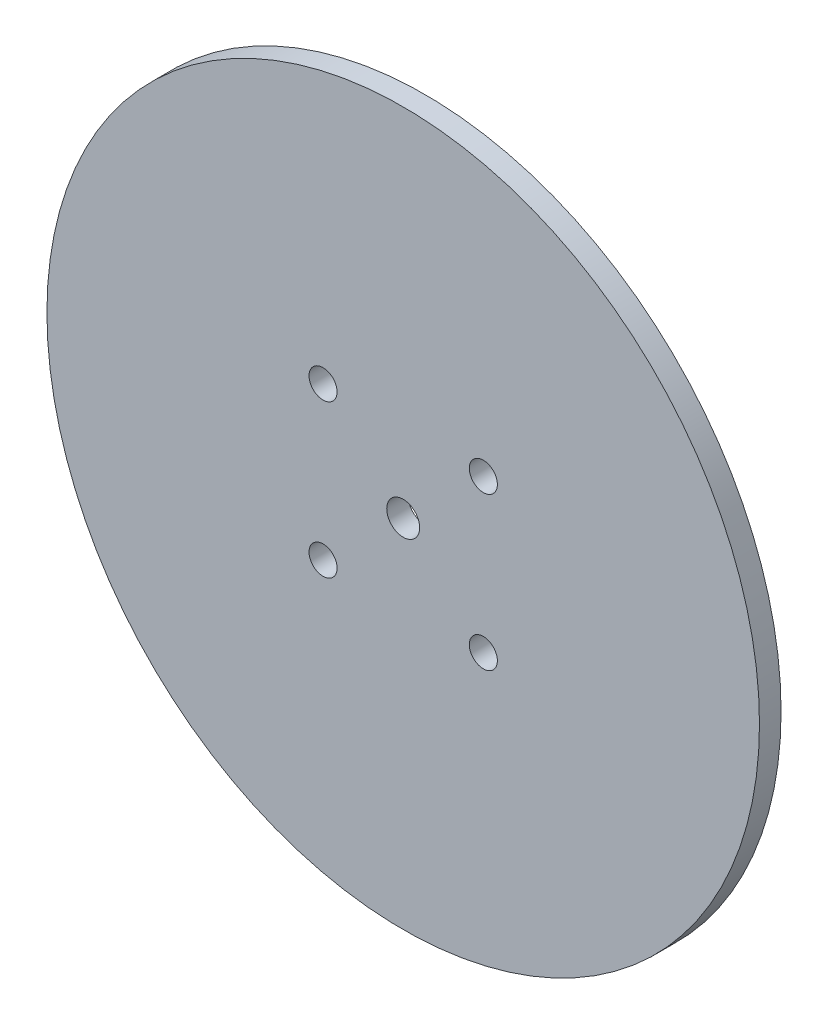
SolidWorks part; units mm, degrees
ref_plane "正面" through (0, 0, 0) normal (0, 0, 1) x (1, 0, 0)
ref_plane "平面" through (0, 0, 0) normal (0, 1, 0) x (1, 0, 0)
ref_plane "右側面" through (0, 0, 0) normal (1, 0, 0) x (0, 0, -1)
sketch "ｽｹｯﾁ1" plane through (0, 0, 0) normal (0, 0, 1) x (1, 0, 0)
  circle A0 centre (0, 0) radius 66
  dimension "D1" = 132
extrude "ﾎﾞｽ - 押し出し3" add sketch "ｽｹｯﾁ1" along normal blind 4
sketch "ｽｹｯﾁ15" plane through (0, 0, 0) normal (0, 0, -1) x (-1, 0, 0)
  circle A0 centre (-14.8459, 14.1368) radius 2.6
  circle A1 centre (14.8459, 14.1368) radius 2.6
  circle A2 centre (14.8459, -14.1368) radius 2.6
  circle A3 centre (-14.8459, -14.1368) radius 2.6
  dimension "D2" = 5.2
  dimension "D5" = 20.5
  dimension "D6" = 20.5
  dimension "D7" = 20.5
  dimension "D8" = 20.5
extrude "ｶｯﾄ - 押し出し1" cut sketch "ｽｹｯﾁ15" against normal through all
ref_plane "平面1" through (0, 50, 0) normal (0, 1, 0) x (1, 0, 0)
ref_plane "平面2" through (50, 0, 0) normal (1, 0, 0) x (0, 0, -1)
ref_plane "平面4" through (0, -50, 0) normal (0, 1, 0) x (1, 0, 0)
ref_plane "平面5" through (-50, 0, 0) normal (1, 0, 0) x (0, 0, -1)
sketch "ｽｹｯﾁ17" plane through (0, 0, 0) normal (0, 0, -1) x (-1, 0, 0)
  circle A0 centre (0, 0) radius 3.05
extrude "ｶｯﾄ - 押し出し2" cut sketch "ｽｹｯﾁ17" against normal through all
